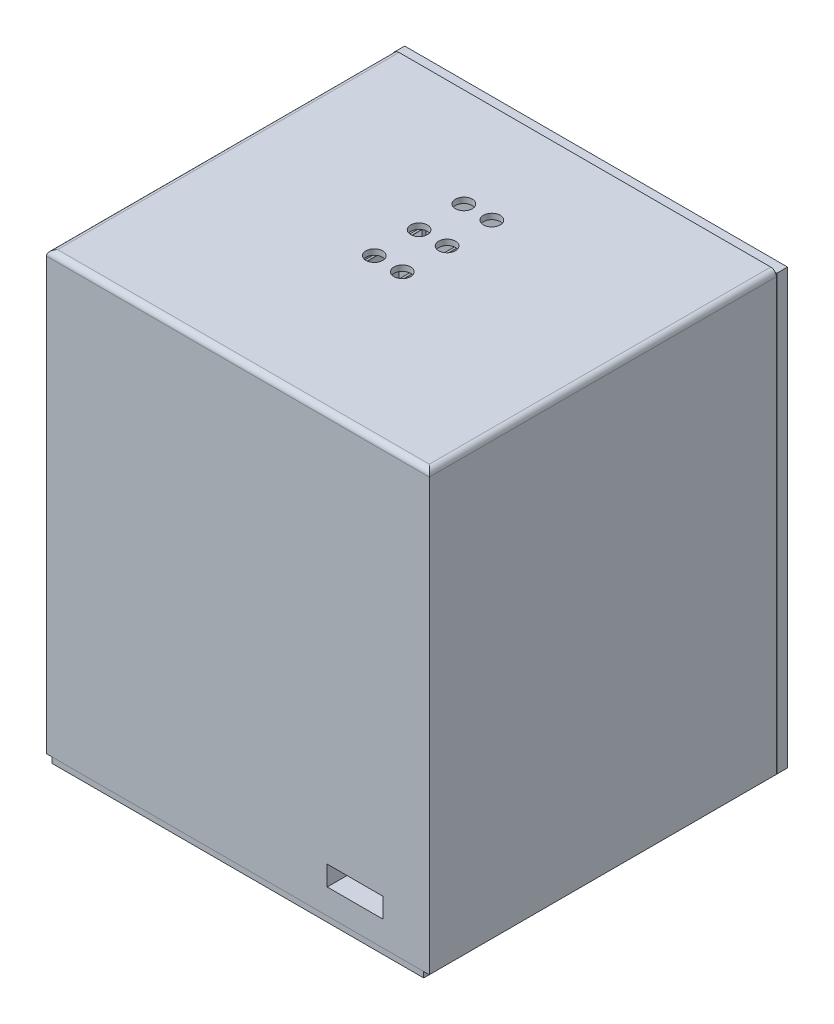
SolidWorks part; units mm, degrees
ref_plane "Front Plane" through (0, 0, 0) normal (0, 0, 1) x (1, 0, 0)
ref_plane "Top Plane" through (0, 0, 0) normal (0, 1, 0) x (1, 0, 0)
ref_plane "Right Plane" through (0, 0, 0) normal (1, 0, 0) x (0, 0, -1)
imported_body "de 2-1-solid1"
imported_body "de 2-1-solid2"
imported_body "de 2-1-solid3"
imported_body "de 2-1-solid4"
imported_body "de 2-1-solid5"
imported_body "de 2-1-solid7"
imported_body "de 2-1-solid8"
imported_body "de 2-1-solid9"
imported_body "Fridge Shelf-1-solid1"
imported_body "Fridge Shelf-1-solid2"
imported_body "Fridge Shelf-1-solid3"
imported_body "Fridge Shelf-1-solid4"
imported_body "Fridge Shelf-1-solid5"
imported_body "Fridge Shelf-1-solid6"
imported_body "Fridge Shelf-1-solid7"
imported_body "Fridge Shelf-1-solid8"
imported_body "Fridge Shelf-1-solid9"
imported_body "Fridge Shelf-1-solid10"
imported_body "Fridge Shelf-1-solid11"
imported_body "Fridge Shelf-1-solid12"
imported_body "Fridge Shelf-1-solid13"
imported_body "Fridge Shelf-1-solid14"
imported_body "Fridge Shelf-1-solid15"
imported_body "Fridge Shelf-1-solid16"
imported_body "Fridge Shelf-1-solid17"
imported_body "Fridge Shelf-1-solid18"
imported_body "Fridge Shelf-1-solid19"
imported_body "Fridge Shelf-1-solid20"
imported_body "Fridge Shelf-1-solid21"
imported_body "Fridge Shelf-1-solid22"
imported_body "Fridge Shelf-1-solid23"
imported_body "Fridge Shelf-1-solid24"
imported_body "Fridge Shelf-1-solid25"
imported_body "Fridge Shelf-1-solid26"
imported_body "Fridge Shelf-1-solid27"
imported_body "Fridge Shelf-1-solid28"
imported_body "Fridge Shelf-1-solid29"
imported_body "Fridge Shelf-1-solid30"
imported_body "Fridge Shelf-1-solid31"
imported_body "Fridge Shelf-1-solid32"
imported_body "Fridge Shelf-1-solid33"
imported_body "Fridge Shelf-2-solid1"
imported_body "Fridge Shelf-2-solid2"
imported_body "Fridge Shelf-2-solid3"
imported_body "Fridge Shelf-2-solid4"
imported_body "Fridge Shelf-2-solid5"
imported_body "Fridge Shelf-2-solid6"
imported_body "Fridge Shelf-2-solid7"
imported_body "Fridge Shelf-2-solid8"
imported_body "Fridge Shelf-2-solid9"
imported_body "Fridge Shelf-2-solid10"
imported_body "Fridge Shelf-2-solid11"
imported_body "Fridge Shelf-2-solid12"
imported_body "Fridge Shelf-2-solid13"
imported_body "Fridge Shelf-2-solid14"
imported_body "Fridge Shelf-2-solid15"
imported_body "Fridge Shelf-2-solid16"
imported_body "Fridge Shelf-2-solid17"
imported_body "Fridge Shelf-2-solid18"
imported_body "Fridge Shelf-2-solid19"
imported_body "Fridge Shelf-2-solid20"
imported_body "Fridge Shelf-2-solid21"
imported_body "Fridge Shelf-2-solid22"
imported_body "Fridge Shelf-2-solid23"
imported_body "Fridge Shelf-2-solid24"
imported_body "Fridge Shelf-2-solid25"
imported_body "Fridge Shelf-2-solid26"
imported_body "Fridge Shelf-2-solid27"
imported_body "Fridge Shelf-2-solid28"
imported_body "Fridge Shelf-2-solid29"
imported_body "Fridge Shelf-2-solid30"
imported_body "Fridge Shelf-2-solid31"
imported_body "Fridge Shelf-2-solid32"
imported_body "Fridge Shelf-2-solid33"
fillet "Fillet1" radius 10
sketch "Sketch1" plane through (0, 900.3414, 0) normal (0, 1, 0) x (1, 0, 0)
  line L0 (39.7778, -552.571) -> (39.7778, -1172.571) construction
  line L1 (371.7778, -552.571) -> (-292.2222, -552.571) construction
  line L2 (381.7778, -1172.571) -> (-302.2222, -1172.571) construction
  circle A0 centre (0, -729.039) radius 15
  circle A1 centre (0, -809.039) radius 15
  circle A2 centre (0, -889.039) radius 15
  circle A3 centre (50, -729.039) radius 15
  circle A4 centre (50, -809.039) radius 15
  circle A5 centre (50, -889.039) radius 15
  dimension "D8" = 30
  dimension "D9" = 30
  dimension "D10" = 30
  dimension "D11" = 30
  dimension "D12" = 30
  dimension "D13" = 30
  dimension "D1" = 50
  dimension "D2" = 50
  dimension "D3" = 50
  dimension "D4" = 80
  dimension "D5" = 80
  dimension "D6" = 80
  dimension "D7" = 80
extrude "Cut-Extrude1" cut sketch "Sketch1" against normal blind 10
sketch "Sketch2" plane through (0, 0, 912.571) normal (0, 0, -1) x (-1, 0, 0)
  line L0 (-371.7778, 130.3414) -> (292.2222, 130.3414) construction
  line L1 (-371.7778, 252.7794) -> (284.7824, 252.7794)
  line L2 (-371.7778, 252.7794) -> (-371.7778, 130.3414)
  line L3 (-371.7778, 130.3414) -> (284.7824, 130.3414)
  line L4 (284.7824, 252.7794) -> (284.7824, 130.3414)
  line L5 (-371.7778, 252.7794) -> (284.7824, 130.3414) construction
  line L6 (-371.7778, 130.3414) -> (284.7824, 252.7794) construction
  line L7 (-371.7778, 380.3414) -> (-371.7778, 130.3414) construction
  point P0 (-43.4977, 191.5604)
extrude "Boss-Extrude1" add sketch "Sketch2" along normal blind 350
sketch "Sketch3" plane through (0, 0, 1172.571) normal (0, 0, 1) x (1, 0, 0)
  line L1 (199.3805, 164.984) -> (298.628, 164.984)
  line L2 (199.3805, 164.984) -> (199.3805, 200.3937)
  line L3 (199.3805, 200.3937) -> (298.628, 200.3937)
  line L4 (298.628, 164.984) -> (298.628, 200.3937)
  line L5 (199.3805, 164.984) -> (298.628, 200.3937) construction
  line L6 (199.3805, 200.3937) -> (298.628, 164.984) construction
  point P0 (249.0042, 182.6888)
extrude "Cut-Extrude2" cut sketch "Sketch3" against normal blind 310
sketch "Sketch4" plane through (0, 0, 912.571) normal (0, 0, -1) x (-1, 0, 0)
